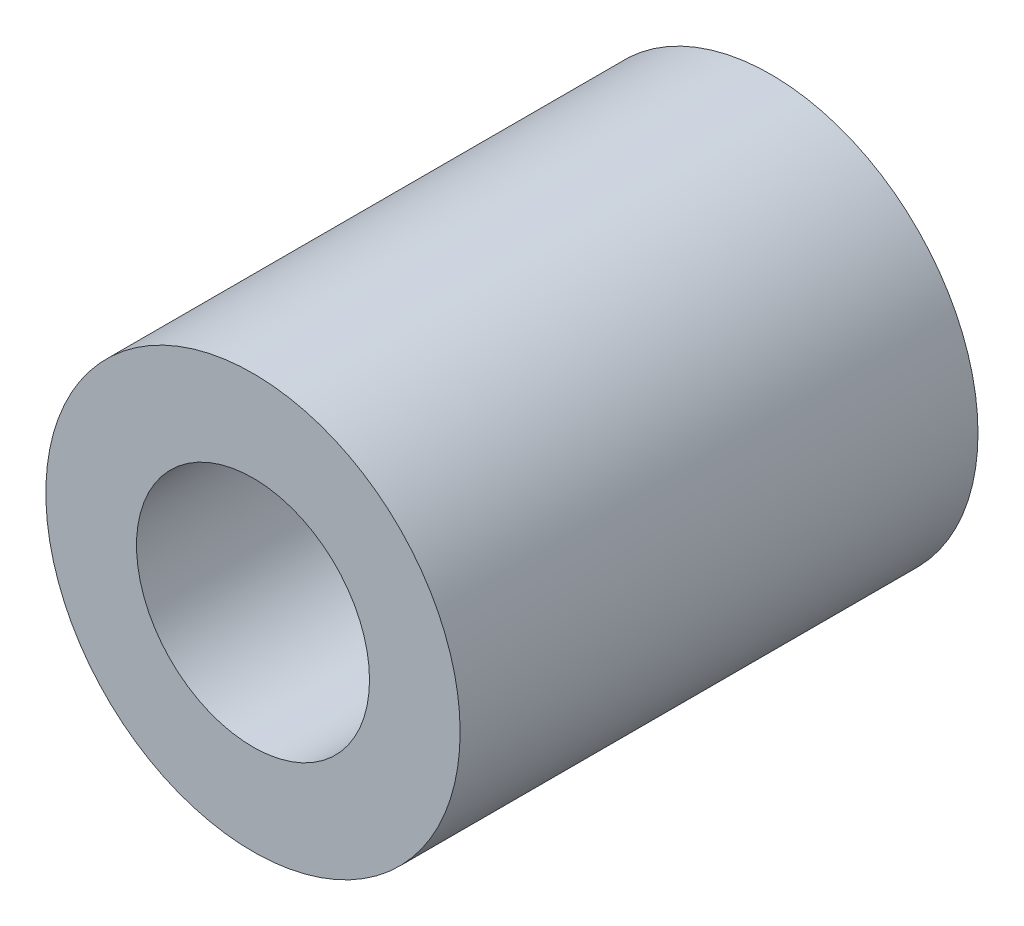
SolidWorks part; units mm, degrees
ref_plane "Przednia" through (0, 0, 0) normal (0, 0, 1) x (1, 0, 0)
ref_plane "Górna" through (0, 0, 0) normal (0, 1, 0) x (1, 0, 0)
ref_plane "Prawa" through (0, 0, 0) normal (1, 0, 0) x (0, 0, -1)
sketch "Szkic1" plane through (0, 0, 0) normal (0, 0, 1) x (1, 0, 0)
  circle A0 centre (0, 0) radius 2.25
  circle A1 centre (0, 0) radius 4
  dimension "D1" = 4.5
  dimension "D2" = 8
extrude "Dodanie-wyciągnięcie1" add sketch "Szkic1" along normal blind 10
